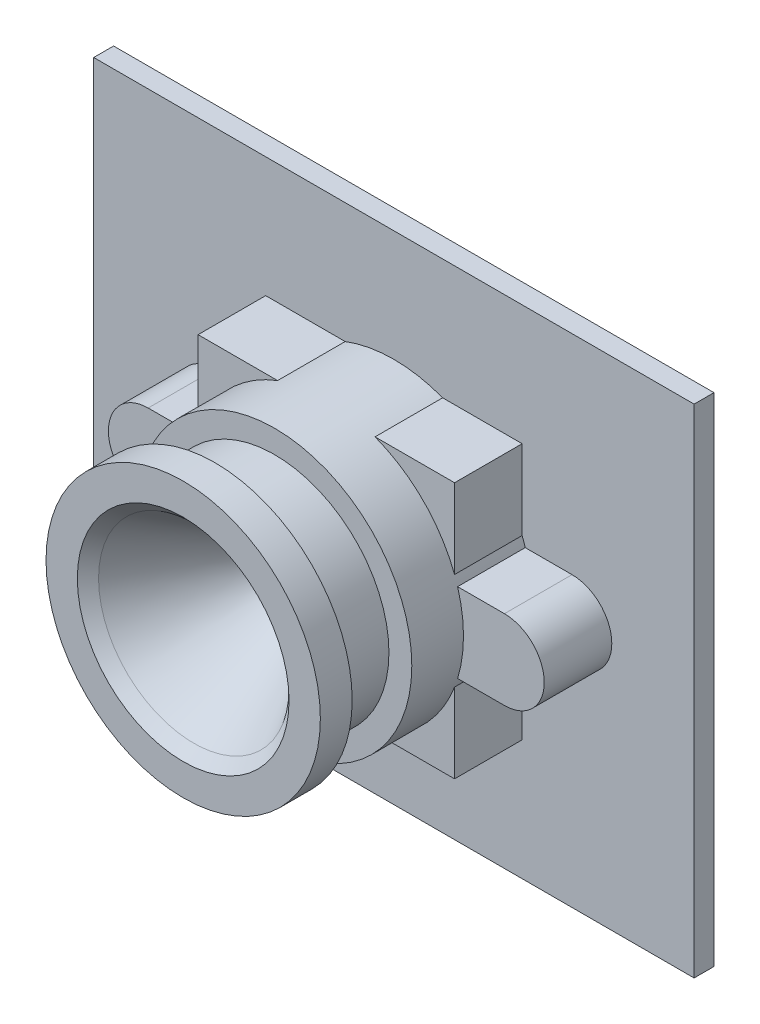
SolidWorks part; units mm, degrees
ref_plane "Front Plane" through (0, 0, 0) normal (0, 0, 1) x (1, 0, 0)
ref_plane "Top Plane" through (0, 0, 0) normal (0, 1, 0) x (1, 0, 0)
ref_plane "Right Plane" through (0, 0, 0) normal (1, 0, 0) x (0, 0, -1)
sketch "Sketch1" plane through (0, 0, 0) normal (0, 0, 1) x (1, 0, 0)
  line L1 (15.1, -12.5) -> (-15.1, -12.5)
  line L2 (15.1, -12.5) -> (15.1, 12.5)
  line L3 (15.1, 12.5) -> (-15.1, 12.5)
  line L4 (-15.1, -12.5) -> (-15.1, 12.5)
  line L5 (15.1, -12.5) -> (-15.1, 12.5) construction
  line L6 (15.1, 12.5) -> (-15.1, -12.5) construction
  point P0 (0, 0)
  dimension "D1" = 30.2
  dimension "D2" = 25
extrude "Boss-Extrude1" add sketch "Sketch1" along normal blind 1
sketch "Sketch2" plane through (0, 0, 1) normal (0, 0, 1) x (1, 0, 0)
  line L1 (6.45, -6.45) -> (-6.45, -6.45)
  line L2 (6.45, -6.45) -> (6.45, 6.45)
  line L3 (6.45, 6.45) -> (-6.45, 6.45)
  line L4 (-6.45, -6.45) -> (-6.45, 6.45)
  line L5 (6.45, -6.45) -> (-6.45, 6.45) construction
  line L6 (6.45, 6.45) -> (-6.45, -6.45) construction
  point P0 (0, 0)
  dimension "D1" = 12.9
extrude "Boss-Extrude2" add sketch "Sketch2" along normal blind 3.4
sketch "Sketch3" plane through (0, 0, 1) normal (0, 0, 1) x (1, 0, 0)
  circle A0 centre (0, 0) radius 6.9
  dimension "D1" = 13.8
extrude "Boss-Extrude3" add sketch "Sketch3" along normal blind 6
sketch "Sketch4" plane through (0, 0, 7) normal (0, 0, 1) x (1, 0, 0)
  circle A0 centre (0, 0) radius 5.75
  dimension "D1" = 11.5
extrude "Boss-Extrude4" add sketch "Sketch4" along normal blind 3
sketch "Sketch5" plane through (0, 0, 10) normal (0, 0, 1) x (1, 0, 0)
  circle A1 centre (0, 0) radius 6.9
  circle A2 centre (0, 0) radius 6.9 construction
extrude "Boss-Extrude5" add sketch "Sketch5" along normal blind 1.6
sketch "Sketch6" plane through (0, 0, 11.6) normal (0, 0, 1) x (1, 0, 0)
  circle A0 centre (0, 0) radius 5.125
  dimension "D1" = 10.25
extrude "Cut-Extrude1" cut sketch "Sketch6" against normal blind 5.65 draft 32
chamfer "Chamfer1" distance 0.2 angle 45 1 edges at (5.125, 0, 11.6)
sketch "Sketch7" plane through (0, 0, 0) normal (0, 0, -1) x (-1, 0, 0)
  line L0 (15.1, -12.5) -> (-15.1, -12.5) construction
  line L1 (1.8, -12.5) -> (9.1, -12.5)
  line L2 (1.8, -12.5) -> (1.8, -8.1)
  line L3 (1.8, -8.1) -> (9.1, -8.1)
  line L4 (9.1, -12.5) -> (9.1, -8.1)
  line L5 (15.1, 12.5) -> (15.1, -12.5) construction
  dimension "D1" = 7.3
  dimension "D2" = 4.4
  dimension "D3" = 6
extrude "Boss-Extrude6" add sketch "Sketch7" along normal blind 3.25 separate body
sketch "Sketch8" plane through (0, -12.5, 0) normal (0, -1, 0) x (1, 0, 0)
  line L1 (-8.7, -0.4) -> (-2.2, -0.4)
  line L2 (-9.1, 0) -> (-1.8, 0) construction
  line L3 (-9.1, 0) -> (-9.1, -3.25) construction
  line L4 (-9.1, -3.25) -> (-1.8, -3.25) construction
  line L5 (-1.8, 0) -> (-1.8, -3.25) construction
  line L6 (-2.2, -0.4) -> (-2.2, -2.85)
  line L7 (-8.7, -2.85) -> (-2.2, -2.85)
  line L8 (-8.7, -0.4) -> (-8.7, -2.85)
  dimension "D1" = 0.4
extrude "Cut-Extrude2" cut sketch "Sketch8" against normal blind 4
sketch "Sketch9" plane through (0, 0, 4.4) normal (0, 0, 1) x (1, 0, 0)
  line L0 (8.96, 0) -> (-8.96, 0) construction
  line L1 (8.96, -2) -> (-8.96, -2)
  line L2 (8.96, 2) -> (-8.96, 2)
  arc A0 (8.96, -2) -> (8.96, 2) centre (8.96, 0) ccw
  arc A1 (-8.96, 2) -> (-8.96, -2) centre (-8.96, 0) ccw
  point P2 (0, 0)
  point P8 (-10.96, 0)
  point P9 (10.96, 0)
  dimension "D1" = 4
  dimension "D2" = 21.92
extrude "Boss-Extrude7" add sketch "Sketch9" against normal up to surface (3.4 mm away)
